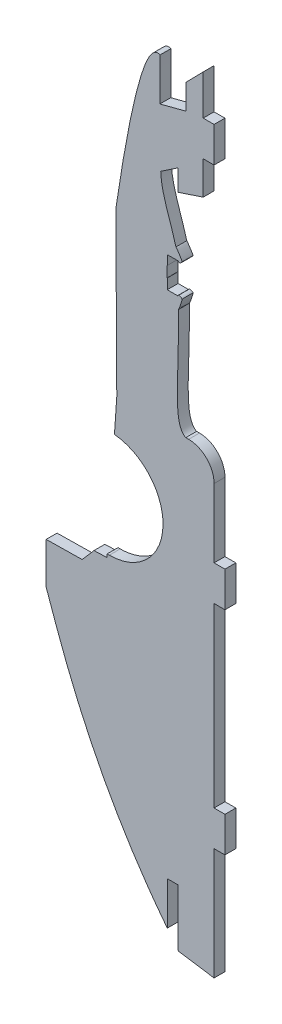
SolidWorks part; units mm, degrees
ref_plane "Alzado" through (0, 0, 0) normal (0, 0, 1) x (1, 0, 0)
ref_plane "Planta" through (0, 0, 0) normal (0, 1, 0) x (1, 0, 0)
ref_plane "Vista lateral" through (0, 0, 0) normal (1, 0, 0) x (0, 0, -1)
sketch "Croquis2" plane through (0, 0, 0) normal (0, 0, 1) x (1, 0, 0)
sketch_block_instance "F1 CAR CUT corte-1"
sketch_block "Bloque1"
extrude "Saliente-Extruir1" add sketch "Croquis2" along normal blind 3
delete or keep bodies "Sólido-Eliminar/Conservar 5" type delete bodies bodies 109 107
delete or keep bodies "Sólido-Eliminar/Conservar 6" type delete bodies bodies 106 111
delete or keep bodies "Sólido-Eliminar/Conservar 7" type delete bodies bodies 105
delete or keep bodies "Sólido-Eliminar/Conservar 8" type delete bodies bodies 114 102 101 103 112 108 104 113
